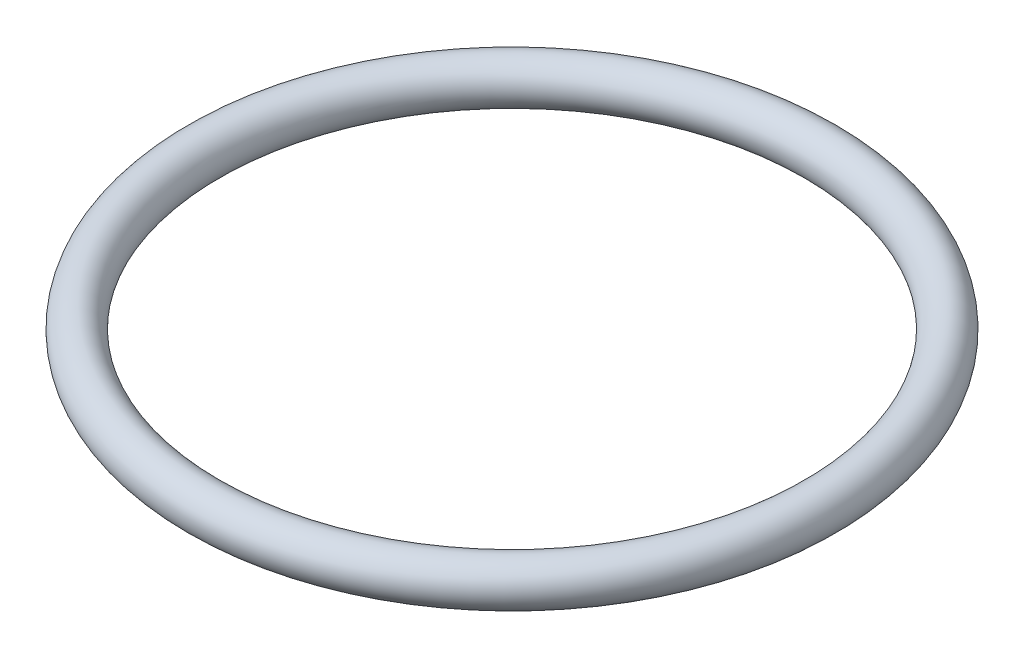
SolidWorks part; units mm, degrees
ref_plane "Plan1" through (0, 0, 0) normal (0, 0, 1) x (1, 0, 0)
ref_plane "Plan2" through (0, 0, 0) normal (0, 1, 0) x (1, 0, 0)
ref_plane "Plan3" through (0, 0, 0) normal (1, 0, 0) x (0, 0, -1)
sketch "Esquisse1" plane through (0, 0, 0) normal (0, 0, 1) x (1, 0, 0)
  line L1 (0, 0) -> (75, 0) construction
  line L2 (0, 2.85) -> (0, -2.85) construction
  circle A0 centre (40.35, 0) radius 2.85
  dimension "D2" = 40.35
  dimension "D1" = 5.7
  dimension "Diamètre du tore" = 5.7
  dimension "Diamètre intérieur" = 75
revolve "Base-Révolution" add sketch "Esquisse1" angle 360 about L2
equation " \"D1@Esquisse1\"=\"Diamètre du tore@Esquisse1\" "
equation "\"D2@Esquisse1\" = (\"Diamètre intérieur@Esquisse1\"/2)+(\"Diamètre du tore@Esquisse1\"/2)"
